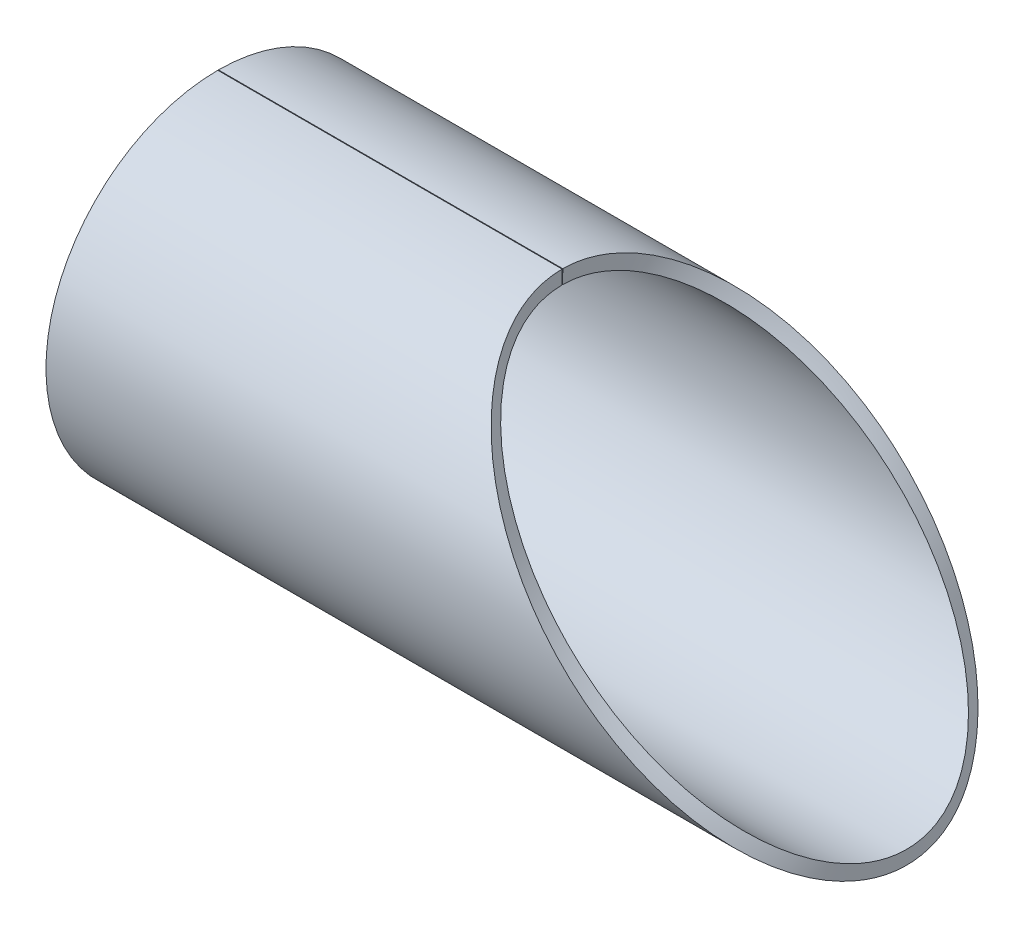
SolidWorks part; units mm, degrees
ref_plane "Ebene vorne" through (0, 0, 0) normal (0, 0, 1) x (1, 0, 0)
ref_plane "Ebene oben" through (0, 0, 0) normal (0, 1, 0) x (1, 0, 0)
ref_plane "Ebene rechts" through (0, 0, 0) normal (1, 0, 0) x (0, 0, -1)
sketch "Skizze1" plane through (0, 0, 0) normal (1, 0, 0) x (0, 0, -1)
  line L0 (0, 0) -> (-0.0759, 37.9333) construction
  line L1 (-0.0759, 37.9333) -> (0.0759, 37.9333) construction
  line L2 (0.0759, 37.9333) -> (0, 0) construction
  line L3 (0, 0) -> (0, 44.032) construction
  arc A0 (-0.05, 24.9999) -> (0.05, 24.9999) centre (0, 0) ccw
  dimension "D1" = 50
  dimension "D2" = 0.1
extrude "Linear-Austragen-Dünn1" add sketch "Skizze1" along normal blind 100 thin
sketch "Skizze2" plane through (0, 0, 0) normal (0, 0, 1) x (1, 0, 0)
  line L0 (50, 25) -> (100, -25)
  line L1 (100, -25) -> (100, 25)
  line L2 (100, 25) -> (50, 25)
  line L3 (-25.6204, 0) -> (134.96, 0) construction
  line L4 (0, -25) -> (100, -25) construction
  line L5 (100, -25) -> (100, 24.9999) construction
  dimension "D1" = 25
  dimension "D2" = 45
extrude "Schnitt-Linear austragen1" cut sketch "Skizze2" against normal through all and the other way through all
sheet metal parameters "Blech1" parameters "D1"=2
bend "Biegung-Rundung1" bend radius 23 bend angle 359.771 parameters "D5"=1
flatten bends "Abwickeln1" parameters "D1"=0
sketch "Skizze-Winkel1" plane through (25, 24.9999, 0.05) normal (0, 1, 0.002) x (-1, 0, 0)
  line L0 (-27, 74.4083) -> (25, 74.4083) construction
process bends "Abbiegen1" parameters "D1"=0
sketch "Abwicklung-Skizze1" plane through (25, 24.9999, 0.05) normal (0, 1, 0.002) x (-1, 0, 0)
